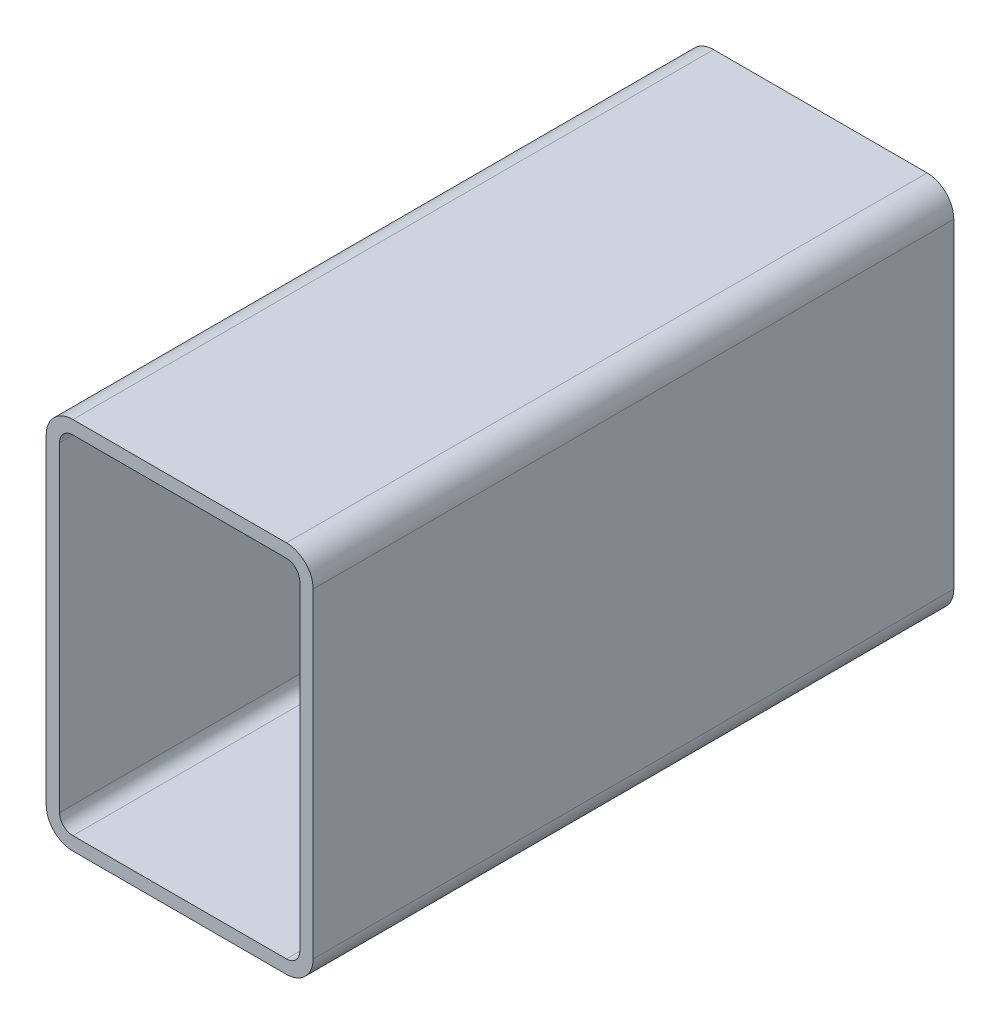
SolidWorks part; units mm, degrees
ref_plane "Front Plane" through (0, 0, 0) normal (0, 0, 1) x (1, 0, 0)
ref_plane "Top Plane" through (0, 0, 0) normal (0, 1, 0) x (1, 0, 0)
ref_plane "Right Plane" through (0, 0, 0) normal (1, 0, 0) x (0, 0, -1)
sketch "Sketch1" plane through (0, 0, 0) normal (0, 0, 1) x (1, 0, 0)
sketch_block_instance "HSS7x5x0.250-1"
sketch_block "HSS7x5x0.250"
extrude "Boss-Extrude1" add sketch "Sketch1" along normal blind 304.8
